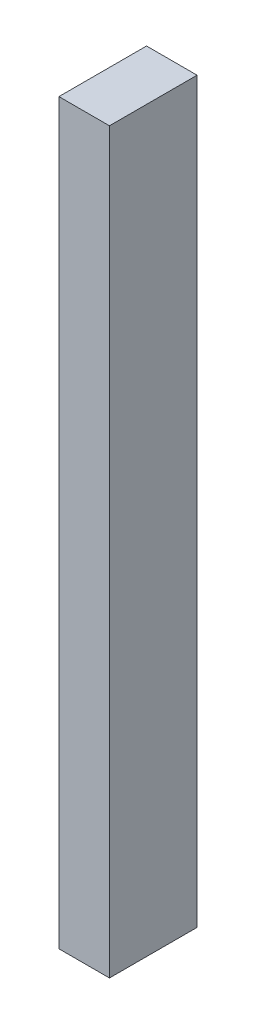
SolidWorks part; units mm, degrees
ref_plane "前基準面" through (0, 0, 0) normal (0, 0, 1) x (1, 0, 0)
ref_plane "上基準面" through (0, 0, 0) normal (0, 1, 0) x (1, 0, 0)
ref_plane "右基準面" through (0, 0, 0) normal (1, 0, 0) x (0, 0, -1)
sketch "草圖1" plane through (0, 0, 0) normal (0, 0, 1) x (1, 0, 0)
  line L1 (-1.5, 21.9) -> (1.5, 21.9)
  line L2 (-1.5, 21.9) -> (-1.5, -21.9)
  line L3 (-1.5, -21.9) -> (1.5, -21.9)
  line L4 (1.5, 21.9) -> (1.5, -21.9)
  line L5 (-1.5, 21.9) -> (1.5, -21.9) construction
  line L6 (-1.5, -21.9) -> (1.5, 21.9) construction
  point P0 (0, 0)
  dimension "D1" = 3
  dimension "D2" = 43.8
extrude "填料-伸長1" add sketch "草圖1" along normal blind 5.2
